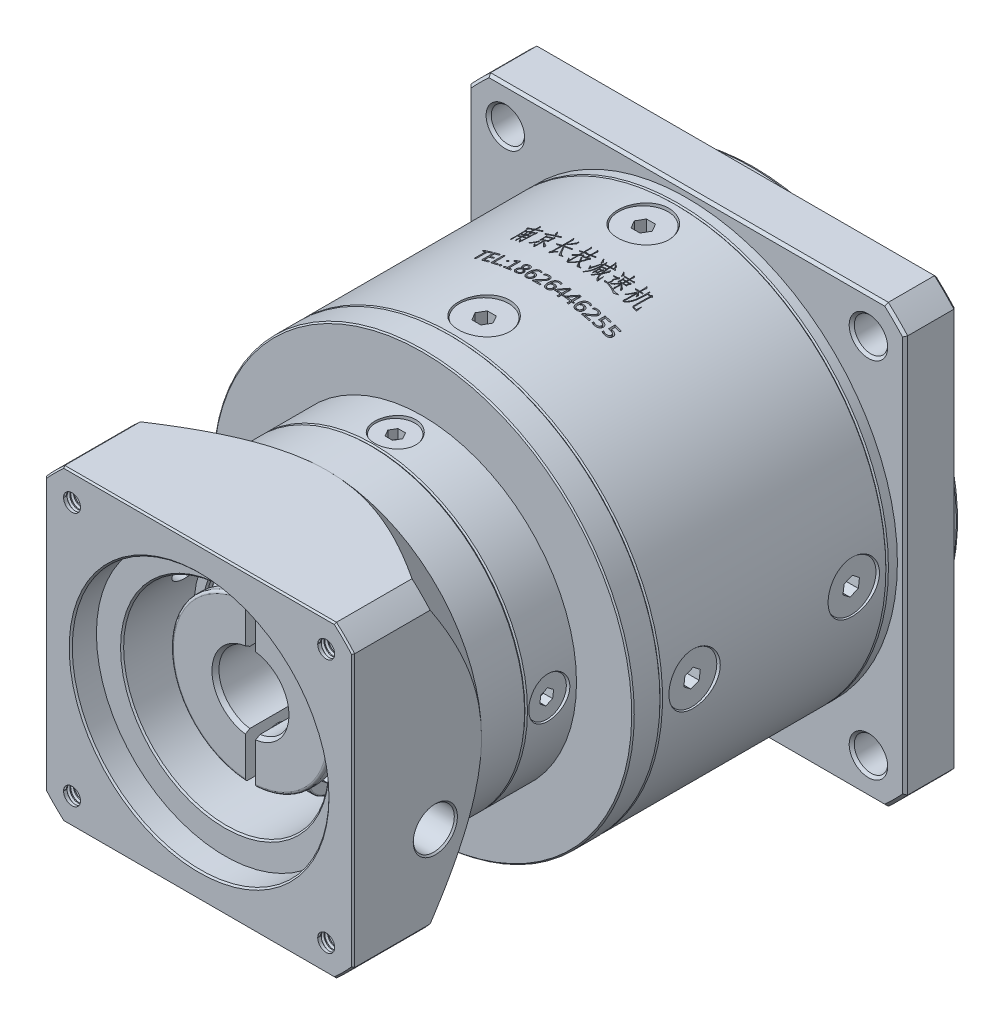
SolidWorks part; units mm, degrees
ref_plane "前视基准面" through (0, 0, 0) normal (0, 0, 1) x (1, 0, 0)
ref_plane "上视基准面" through (0, 0, 0) normal (0, 1, 0) x (1, 0, 0)
ref_plane "右视基准面" through (0, 0, 0) normal (1, 0, 0) x (0, 0, -1)
imported_body "14-50-70-M4-1-solid1"
imported_body "14-50-70-M4-1-solid2"
imported_body "14-50-70-M4-1-solid3"
imported_body "14-50-70-M4-1-solid4"
imported_body "14-50-70-M4-1-solid5"
imported_body "ZF80-K15-L2-F60-6-solid1"
imported_body "ZF80-K15-L2-F60-6-solid2"
imported_body "ZF80-K15-L2-F60-6-solid3"
imported_body "ZF80-K15-L2-F60-6-solid4"
imported_body "ZF80-K15-L2-F60-6-solid5"
imported_body "ZF80-K15-L2-F60-6-solid6"
imported_body "ZF80-K15-L2-F60-6-solid7"
imported_body "ZF80-K15-L2-F60-6-solid8"
imported_body "ZF80-K15-L2-F60-6-solid9"
imported_body "ZF80-K15-L2-F60-6-solid10"
imported_body "ZF80-K15-L2-F60-6-solid11"
imported_body "ZF80-K15-L2-F60-6-solid12"
imported_body "ZF80-K15-L2-F60-6-solid13"
sketch "草图1" plane through (0, 0, -46.3056) normal (0, 0, -1) x (-1, 0, 0)
  circle A0 centre (62.1273, 18.4518) radius 11.1875
  dimension "D1" = 22.3749
extrude "凸台-拉伸1" add sketch "草图1" along normal blind 5
